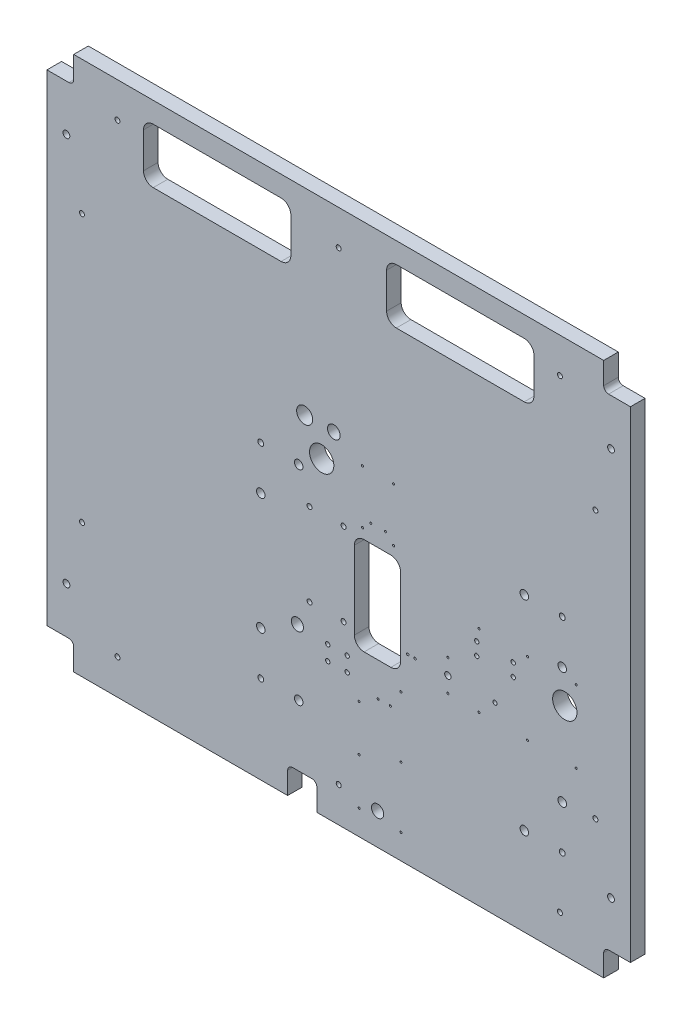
SolidWorks part; units mm, degrees
ref_plane "Ebene vorne" through (0, 0, 0) normal (0, 0, 1) x (1, 0, 0)
ref_plane "Ebene oben" through (0, 0, 0) normal (0, 1, 0) x (1, 0, 0)
ref_plane "Ebene rechts" through (0, 0, 0) normal (1, 0, 0) x (0, 0, -1)
sketch "Skizze1" plane through (0, 0, 0) normal (0, 0, 1) x (1, 0, 0)
  line L1 (-600, -550) -> (600, -550)
  line L2 (-600, -550) -> (-600, 550)
  line L3 (-600, 550) -> (600, 550)
  line L4 (600, -550) -> (600, 550)
  line L5 (-600, -550) -> (600, 550) construction
  line L6 (-600, 550) -> (600, -550) construction
  point P0 (0, 0)
  dimension "D1" = 1200
  dimension "D2" = 1100
extrude "Aufsatz-Linear austragen1" add sketch "Skizze1" along normal blind 30
sketch "Skizze2" plane through (0, 0, 0) normal (0, 0, -1) x (-1, 0, 0)
  line L1 (-32.2293, -215.6) -> (-127.2293, -215.6)
  line L2 (-32.2293, -215.6) -> (-32.2293, -15.6)
  line L3 (-32.2293, -15.6) -> (-127.2293, -15.6)
  line L12 (-127.2293, -215.6) -> (-127.2293, -15.6)
  line L16 (-52.2293, -25.6) -> (-107.2293, -25.6) construction
  line L17 (-42.2293, -195.6) -> (-42.2293, -35.6) construction
  line L18 (-107.2293, -205.6) -> (-52.2293, -205.6) construction
  line L19 (-117.2293, -195.6) -> (-117.2293, -35.6) construction
  dimension "D2" = 10
  dimension "D3" = 10
  dimension "D4" = 10
  dimension "D1" = 10
extrude "Schnitt-Linear austragen1" cut sketch "Skizze2" against normal through all
hole_wizard "Durchgangsloch für M81" positions "Skizze7" profile "Skizze6" hole size "M8" standard "DIN"
sketch "Skizze7" plane through (0, 0, 30) normal (0, 0, 1) x (1, 0, 0)
  circle A2 centre (358.9553, -80.947) radius 5.1167
  circle A3 centre (358.9553, -80.947) radius 3.4 construction
  circle A4 centre (358.9553, -80.947) radius 3.4
  point P0 (358.9553, -80.947)
sketch "Skizze6" plane through (358.9553, -80.947, 30) normal (1, 0, 0) x (0, -1, 0)
  line L0 (0, 0) -> (0, 30)
  line L1 (0, 30) -> (4.5, 30)
  line L2 (4.5, 30) -> (4.5, 0)
  line L5 (4.5, 0) -> (0, 0)
  line L11 (0, -6.35) -> (0, 107.95) construction
  dimension "Bohrerdurchmesser" = 9
  dimension "Bohrungstiefe" = 30
pattern_linear "Lineares Muster1" count 2 spacing 75 along (-1, 0, 0) count 2 spacing 26 along (0, -1, 0) of "Durchgangsloch für M81"
hole_wizard "M10 Gewindebohrung1" positions "Skizze9" profile "Skizze8" tap size "M10" standard "DIN"
sketch "Skizze9" plane through (0, 0, 0) normal (0, 0, -1) x (-1, 0, 0)
  circle A0 centre (-321.4553, -171.447) radius 5 construction
  circle A1 centre (-321.4553, -171.447) radius 5
  point P0 (-321.4553, -171.447)
sketch "Skizze8" plane through (321.4553, -171.447, 0) normal (1, 0, 0) x (0, 1, 0)
  line L0 (0, 0) -> (0, 30)
  line L1 (0, 30) -> (4.25, 30)
  line L2 (4.25, 30) -> (4.25, 0)
  line L5 (4.25, 0) -> (0, 0)
  line L11 (0, -6.35) -> (0, 107.95) construction
  dimension "Bohrerdurchmesser" = 8.5
  dimension "Bohrungstiefe" = 30
hole_wizard "M5 Gewindebohrung1" positions "Skizze11" profile "Skizze10" tap size "M5" standard "DIN"
sketch "Skizze11" plane through (0, 0, 0) normal (0, 0, -1) x (-1, 0, 0)
  circle A0 centre (-65.9283, 20.553) radius 2.75 construction
  circle A1 centre (-65.9283, 20.553) radius 2.75
  circle A2 centre (-95.9283, 20.553) radius 2.75 construction
  circle A3 centre (-95.9283, 20.553) radius 2.75
  point P0 (-65.9283, 20.553)
  point P1 (-95.9283, 20.553)
sketch "Skizze10" plane through (65.9283, 20.553, 0) normal (1, 0, 0) x (0, 1, 0)
  line L0 (0, 0) -> (0, 30)
  line L1 (0, 30) -> (2.1, 30)
  line L2 (2.1, 30) -> (2.1, 0)
  line L5 (2.1, 0) -> (0, 0)
  line L11 (0, -6.35) -> (0, 107.95) construction
  dimension "Bohrerdurchmesser" = 4.2
  dimension "Bohrungstiefe" = 30
hole_wizard "M5 Gewindebohrung2" positions "Skizze13" profile "Skizze12" tap size "M5" standard "DIN"
sketch "Skizze13" plane through (0, 0, 30) normal (0, 0, 1) x (1, 0, 0)
  circle A0 centre (106.2293, -284.927) radius 2.75 construction
  circle A1 centre (81.2293, -284.927) radius 2.75 construction
  circle A2 centre (106.2293, -284.927) radius 2.75
  circle A3 centre (81.2293, -284.927) radius 2.75
  point P0 (106.2293, -284.927)
  point P1 (81.2293, -284.927)
sketch "Skizze12" plane through (106.2293, -284.927, 30) normal (1, 0, 0) x (0, -1, 0)
  line L0 (0, 0) -> (0, 30)
  line L1 (0, 30) -> (2.1, 30)
  line L2 (2.1, 30) -> (2.1, 0)
  line L5 (2.1, 0) -> (0, 0)
  line L11 (0, -6.35) -> (0, 107.95) construction
  dimension "Bohrerdurchmesser" = 4.2
  dimension "Bohrungstiefe" = 30
hole_wizard "M5 Gewindebohrung3" positions "Skizze15" profile "Skizze14" tap size "M5" standard "DIN"
sketch "Skizze15" plane through (0, 0, 30) normal (0, 0, 1) x (1, 0, 0)
  circle A0 centre (224.4553, -139.447) radius 2.75 construction
  circle A1 centre (224.4553, -203.447) radius 2.75 construction
  circle A2 centre (224.4553, -139.447) radius 2.75
  circle A3 centre (224.4553, -203.447) radius 2.75
  point P0 (224.4553, -139.447)
  point P1 (224.4553, -203.447)
sketch "Skizze14" plane through (224.4553, -139.447, 30) normal (1, 0, 0) x (0, -1, 0)
  line L0 (0, 0) -> (0, 30)
  line L1 (0, 30) -> (2.1, 30)
  line L2 (2.1, 30) -> (2.1, 0)
  line L5 (2.1, 0) -> (0, 0)
  line L11 (0, -6.35) -> (0, 107.95) construction
  dimension "Bohrerdurchmesser" = 4.2
  dimension "Bohrungstiefe" = 30
hole_wizard "Ø13.0 (13) Durchmesser Bohrung1" positions "Skizze17" profile "Skizze16" hole size "Ø13.0" standard "DIN"
sketch "Skizze17" plane through (0, 0, 0) normal (0, 0, -1) x (-1, 0, 0)
  circle A0 centre (-224.4553, -171.447) radius 4.75 construction
  point P0 (-224.4553, -171.447)
sketch "Skizze16" plane through (224.4553, -171.447, 0) normal (1, 0, 0) x (0, 1, 0)
  line L0 (0, 0) -> (0, 30)
  line L1 (0, 30) -> (6.5, 30)
  line L2 (6.5, 30) -> (6.5, 0)
  line L5 (6.5, 0) -> (0, 0)
  line L11 (0, -6.35) -> (0, 107.95) construction
  dimension "Bohrerdurchmesser" = 13
  dimension "Bohrungstiefe" = 30
sketch "Skizze18" plane through (0, 0, 0) normal (0, 0, -1) x (-1, 0, 0)
  line L0 (600, -550) -> (-600, -550) construction
  line L1 (-600, 550) -> (-545, 550)
  line L2 (-600, 550) -> (-600, 495)
  line L3 (-600, 495) -> (-545, 495)
  line L4 (-545, 550) -> (-545, 495)
  line L5 (600, 550) -> (545, 550)
  line L6 (600, 550) -> (600, 495)
  line L7 (600, 495) -> (545, 495)
  line L8 (545, 550) -> (545, 495)
  line L9 (600, -550) -> (545, -550)
  line L10 (600, -550) -> (600, -495)
  line L11 (600, -495) -> (545, -495)
  line L12 (545, -550) -> (545, -495)
  line L13 (-600, -550) -> (-545, -550)
  line L14 (-600, -550) -> (-600, -495)
  line L15 (-600, -495) -> (-545, -495)
  line L16 (-545, -550) -> (-545, -495)
  line L17 (45, -550) -> (105, -550)
  line L18 (45, -550) -> (45, -495)
  line L19 (45, -495) -> (105, -495)
  line L20 (105, -550) -> (105, -495)
  line L21 (600, 550) -> (600, -550) construction
  dimension "D1" = 55
  dimension "D2" = 495
  dimension "D3" = 60
extrude "Schnitt-Linear austragen2" cut sketch "Skizze18" against normal through all
hole_wizard "M16 Gewindebohrung1" positions "Skizze20" profile "Skizze19" tap size "M16" standard "DIN"
sketch "Skizze20" plane through (0, 0, 0) normal (0, 0, -1) x (-1, 0, 0)
  line L0 (-600, -495) -> (-600, 495) construction
  line L1 (600, 495) -> (600, -495) construction
  line L2 (-545, 550) -> (545, 550) construction
  line L3 (545, -550) -> (105, -550) construction
  point P0 (-560, -400)
  point P1 (-560, 400)
  point P3 (560, 400)
  point P5 (560, -400)
  dimension "D1" = 40
  dimension "D2" = 40
  dimension "D3" = 150
  dimension "D4" = 150
sketch "Skizze19" plane through (560, -400, 0) normal (1, 0, 0) x (0, 1, 0)
  line L0 (0, 0) -> (0, 30)
  line L1 (0, 30) -> (7, 30)
  line L2 (7, 30) -> (7, 0)
  line L5 (7, 0) -> (0, 0)
  line L11 (0, -6.35) -> (0, 107.95) construction
  dimension "Bohrerdurchmesser" = 14
  dimension "Bohrungstiefe" = 30
hole_wizard "M6 Gewindebohrung1" positions "Skizze22" profile "Skizze21" tap size "M6" standard "DIN"
sketch "Skizze22" plane through (0, 0, 0) normal (0, 0, -1) x (-1, 0, 0)
  circle A0 centre (-157, -175) radius 3.3 construction
  circle A1 centre (-142, -175) radius 3.3 construction
  point P0 (-157, -175)
  point P1 (-142, -175)
sketch "Skizze21" plane through (157, -175, 0) normal (1, 0, 0) x (0, 1, 0)
  line L0 (0, 0) -> (0, 30)
  line L1 (0, 30) -> (2.5, 30)
  line L2 (2.5, 30) -> (2.5, 0)
  line L5 (2.5, 0) -> (0, 0)
  line L11 (0, -6.35) -> (0, 107.95) construction
  dimension "Bohrerdurchmesser" = 5
  dimension "Bohrungstiefe" = 30
sketch "Skizze25" plane through (0, 0, 30) normal (0, 0, 1) x (1, 0, 0)
  line L0 (-98.5, 394.5) -> (-98.5, 507.5) construction
  line L1 (-401.5, 394.5) -> (-98.5, 394.5) construction
  line L2 (-401.5, 507.5) -> (-401.5, 394.5) construction
  line L3 (-98.5, 507.5) -> (-401.5, 507.5) construction
  line L4 (-98.5, 394.5) -> (-98.5, 507.5)
  line L5 (-401.5, 394.5) -> (-98.5, 394.5)
  line L6 (-401.5, 507.5) -> (-401.5, 394.5)
  line L7 (-98.5, 507.5) -> (-401.5, 507.5)
  line L8 (98.5, 394.5) -> (401.5, 394.5) construction
  line L9 (98.5, 507.5) -> (98.5, 394.5) construction
  line L10 (401.5, 507.5) -> (98.5, 507.5) construction
  line L11 (401.5, 394.5) -> (401.5, 507.5) construction
  line L12 (98.5, 394.5) -> (401.5, 394.5)
  line L13 (98.5, 507.5) -> (98.5, 394.5)
  line L14 (401.5, 507.5) -> (98.5, 507.5)
  line L15 (401.5, 394.5) -> (401.5, 507.5)
extrude "Schnitt-Linear austragen3" cut sketch "Skizze25" against normal through all
hole_wizard "Ø26.0 (26) Durchmesser Bohrung1" positions "Skizze27" profile "Skizze26" hole size "Ø26.0" standard "DIN"
sketch "Skizze27" plane through (0, 0, 0) normal (0, 0, -1) x (-1, 0, 0)
  line L0 (-73.5697, -63.484) -> (-57.497, -24.681) construction
  line L6 (545, -550) -> (105, -550) construction
  line L7 (-600, -495) -> (-600, 495) construction
  point P0 (10, 145)
  dimension "D1" = 695
  dimension "D2" = 610
sketch "Skizze26" plane through (-10, 145, 0) normal (1, 0, 0) x (0, 1, 0)
  line L0 (0, 0) -> (0, 30)
  line L1 (0, 30) -> (13, 30)
  line L2 (13, 30) -> (13, 0)
  line L5 (13, 0) -> (0, 0)
  line L11 (0, -6.35) -> (0, 107.95) construction
  dimension "Bohrerdurchmesser" = 26
  dimension "Bohrungstiefe" = 30
sketch "Skizze30" plane through (0, 0, 0) normal (0, 0, -1) x (-1, 0, 0)
  circle A0 centre (-465, -105) radius 25
  circle A1 centre (35, 85) radius 25
  circle A2 centre (85, -235) radius 12.5
  circle A3 centre (-80, -485) radius 12.5
  circle A4 centre (10, 145) radius 13 construction
  dimension "D1" = 50
  dimension "D7" = 60
  dimension "D8" = 25
  dimension "D11" = 25
  dimension "D2" = 25
  dimension "D3" = 320
  dimension "D4" = 500
  dimension "D5" = 190
  dimension "D6" = 550
  dimension "D9" = 385
  dimension "D10" = 380
extrude "Schnitt-Linear austragen4" cut sketch "Skizze30" against normal through all
hole_wizard "Ø33.0 (33) Durchmesser Bohrung1" positions "Skizze33" profile "Skizze32" hole size "Ø33.0" standard "DIN"
sketch "Skizze33" plane through (0, 0, 0) normal (0, 0, -1) x (-1, 0, 0)
  circle A0 centre (10, 145) radius 13 construction
  circle A1 centre (10, 145) radius 13
  point P0 (70, 145)
  dimension "D1" = 60
sketch "Skizze32" plane through (-70, 145, 0) normal (1, 0, 0) x (0, 1, 0)
  line L0 (0, 0) -> (0, 30)
  line L1 (0, 30) -> (16.5, 30)
  line L2 (16.5, 30) -> (16.5, 0)
  line L5 (16.5, 0) -> (0, 0)
  line L11 (0, -6.35) -> (0, 107.95) construction
  dimension "Bohrerdurchmesser" = 33
  dimension "Bohrungstiefe" = 30
hole_wizard "M5 Gewindebohrung Deckbleche" positions "Skizze35" profile "Skizze34" tap size "M5" standard "DIN"
sketch "Skizze35" plane through (0, 0, 30) normal (0, 0, 1) x (1, 0, 0)
  circle A0 centre (112.9283, 4.053) radius 2.75 construction
  circle A1 centre (48.9283, 4.053) radius 2.75 construction
  circle A2 centre (48.9283, 114.053) radius 2.75 construction
  circle A3 centre (112.9283, 114.053) radius 2.75 construction
  circle A4 centre (488.4553, -55.947) radius 2.75 construction
  circle A5 centre (388.4553, -55.947) radius 2.75 construction
  circle A6 centre (288.4553, -55.947) radius 2.75 construction
  circle A7 centre (488.4553, -204.947) radius 2.75 construction
  circle A8 centre (388.4553, -204.947) radius 2.75 construction
  circle A9 centre (288.4553, -204.947) radius 2.75 construction
  circle A10 centre (128.0293, -248.8515) radius 2.75 construction
  circle A11 centre (128.0293, -373.8515) radius 2.75 construction
  circle A12 centre (128.0293, -498.8515) radius 2.75 construction
  circle A13 centre (42.0293, -498.8515) radius 2.75 construction
  circle A14 centre (42.0293, -403.8515) radius 2.75 construction
  circle A15 centre (42.0293, -308.8515) radius 2.75 construction
  point P0 (288.4553, -204.947)
  point P1 (42.0293, -498.8515)
  point P3 (42.0293, -403.8515)
  point P5 (128.0293, -498.8515)
  point P7 (128.0293, -373.8515)
  point P9 (128.0293, -248.8515)
  point P11 (488.4553, -55.947)
  point P13 (388.4553, -55.947)
  point P15 (288.4553, -55.947)
  point P17 (488.4553, -204.947)
  point P19 (388.4553, -204.947)
  point P21 (48.9283, 114.053)
  point P23 (48.9283, 4.053)
  point P25 (112.9283, 4.053)
  point P27 (112.9283, 114.053)
  point P61 (42.0293, -308.8515)
sketch "Skizze34" plane through (288.4553, -204.947, 30) normal (1, 0, 0) x (0, -1, 0)
  line L0 (0, 0) -> (0, 30)
  line L1 (0, 30) -> (2.1, 30)
  line L2 (2.1, 30) -> (2.1, 0)
  line L5 (2.1, 0) -> (0, 0)
  line L11 (0, -6.35) -> (0, 107.95) construction
  dimension "Bohrerdurchmesser" = 4.2
  dimension "Bohrungstiefe" = 30
hole_wizard "Durchgangsloch für M161" positions "Skizze37" profile "Skizze36" hole size "M16" standard "DIN"
sketch "Skizze37" plane through (0, 0, 0) normal (0, 0, -1) x (-1, 0, 0)
  circle A0 centre (-381.7293, 50.9) radius 7 construction
  circle A1 centre (-459.7293, -39.1) radius 7 construction
  circle A2 centre (-459.7293, -279.1) radius 7 construction
  circle A3 centre (-381.7293, -369.1) radius 7 construction
  circle A4 centre (82.2707, 50.9) radius 7 construction
  circle A5 centre (160.2707, -39.1) radius 7 construction
  circle A6 centre (160.2707, -279.1) radius 7 construction
  circle A7 centre (82.2707, -369.1) radius 7 construction
  point P0 (-381.7293, -369.1)
  point P1 (-459.7293, -39.1)
  point P3 (-381.7293, 50.9)
  point P8 (-459.7293, -279.1)
  point P11 (82.2707, 50.9)
  point P13 (160.2707, -39.1)
  point P15 (160.2707, -279.1)
  point P17 (82.2707, -369.1)
sketch "Skizze36" plane through (381.7293, -369.1, 0) normal (1, 0, 0) x (0, 1, 0)
  line L0 (0, 0) -> (0, 30)
  line L1 (0, 30) -> (8.75, 30)
  line L2 (8.75, 30) -> (8.75, 0)
  line L5 (8.75, 0) -> (0, 0)
  line L11 (0, -6.35) -> (0, 107.95) construction
  dimension "Bohrerdurchmesser" = 17.5
  dimension "Bohrungstiefe" = 30
hole_wizard "Ø12.0 (12) Durchmesser Bohrung1" positions "Skizze39" profile "Skizze38" hole size "Ø12.0" standard "DIN"
sketch "Skizze39" plane through (0, 0, 0) normal (0, 0, -1) x (-1, 0, 0)
  circle A0 centre (-459.7293, 50.9) radius 6 construction
  circle A1 centre (-459.7293, -369.1) radius 6 construction
  circle A2 centre (160.2707, 50.9) radius 6 construction
  circle A3 centre (160.2707, -369.1) radius 6 construction
  point P0 (-459.7293, 50.9)
  point P1 (-459.7293, -369.1)
  point P3 (160.2707, -369.1)
  point P5 (160.2707, 50.9)
sketch "Skizze38" plane through (459.7293, 50.9, 0) normal (1, 0, 0) x (0, 1, 0)
  line L0 (0, 0) -> (0, 30)
  line L1 (0, 30) -> (6, 30)
  line L2 (6, 30) -> (6, 0)
  line L5 (6, 0) -> (0, 0)
  line L11 (0, -6.35) -> (0, 107.95) construction
  dimension "Bohrerdurchmesser" = 12
  dimension "Bohrungstiefe" = 30
hole_wizard "Durchgangsloch für M82" positions "Skizze41" profile "Skizze40" hole size "M8" standard "DIN"
sketch "Skizze41" plane through (0, 0, 30) normal (0, 0, 1) x (1, 0, 0)
  circle A0 centre (17.4553, -239.447) radius 3.4 construction
  circle A1 centre (-22.5447, -239.447) radius 3.4 construction
  circle A2 centre (17.4553, -269.447) radius 3.4 construction
  circle A3 centre (-22.5447, -269.447) radius 3.4 construction
  point P0 (-22.5447, -269.447)
  point P1 (17.4553, -269.447)
  point P3 (17.4553, -239.447)
  point P5 (-22.5447, -239.447)
sketch "Skizze40" plane through (-22.5447, -269.447, 30) normal (1, 0, 0) x (0, -1, 0)
  line L0 (0, 0) -> (0, 30)
  line L1 (0, 30) -> (4.5, 30)
  line L2 (4.5, 30) -> (4.5, 0)
  line L5 (4.5, 0) -> (0, 0)
  line L11 (0, -6.35) -> (0, 107.95) construction
  dimension "Bohrerdurchmesser" = 9
  dimension "Bohrungstiefe" = 30
fillet "Verrundung1" radius 20 8 edges at (401.5, 394.5, 15) (-98.5, 394.5, 15) (98.5, 394.5, 15) (-401.5, 394.5, 15) (-401.5, 507.5, 15) (98.5, 507.5, 15) (-98.5, 507.5, 15) (401.5, 507.5, 15)
fillet "Verrundung2" radius 20 4 edges at (32.2293, -215.6, 15) (127.2293, -215.6, 15) (127.2293, -15.6, 15) (32.2293, -15.6, 15)
hole_wizard "M12 Gewindebohrung3" positions "Skizze43" profile "Skizze42" tap size "M12" standard "DIN"
sketch "Skizze43" plane through (320.3074, -292.1312, 0) normal (0, 0, 1) x (1, 0, 0)
  circle A0 centre (134.6926, 770.1312) radius 7 construction
  circle A1 centre (-320.3074, 770.1312) radius 7 construction
  circle A2 centre (-775.3074, 770.1312) radius 7 construction
  circle A3 centre (-848.3074, 567.1312) radius 7 construction
  circle A4 centre (-848.3074, 17.1312) radius 7 construction
  circle A5 centre (-775.3074, -185.8688) radius 7 construction
  circle A6 centre (-320.3074, -185.8688) radius 7 construction
  circle A7 centre (134.6926, -185.8688) radius 7 construction
  circle A8 centre (207.6926, 17.1312) radius 7 construction
  circle A9 centre (207.6926, 567.1312) radius 7 construction
  circle A10 centre (-310.3074, 109.4099) radius 6.75 construction
  circle A11 centre (-380.3074, 109.4099) radius 6.75 construction
  circle A12 centre (-310.3074, 279.4099) radius 6.75 construction
  circle A13 centre (-380.3074, 279.4099) radius 6.75 construction
  point P0 (134.6926, 770.1312)
  point P1 (-320.3074, 770.1312)
  point P3 (-775.3074, 770.1312)
  point P5 (-848.3074, 567.1312)
  point P7 (-848.3074, 17.1312)
  point P9 (-775.3074, -185.8688)
  point P11 (134.6926, -185.8688)
  point P13 (-320.3074, -185.8688)
  point P15 (207.6926, 567.1312)
  point P17 (207.6926, 17.1312)
  point P42 (-310.3074, 109.4099)
  point P44 (-380.3074, 109.4099)
  point P46 (-310.3074, 279.4099)
  point P48 (-380.3074, 279.4099)
sketch "Skizze42" plane through (455, 478, 0) normal (1, 0, 0) x (0, 1, 0)
  line L0 (0, 0) -> (0, 30)
  line L1 (0, 30) -> (5.1, 30)
  line L2 (5.1, 30) -> (5.1, 0)
  line L5 (5.1, 0) -> (0, 0)
  line L11 (0, -6.35) -> (0, 107.95) construction
  dimension "Bohrerdurchmesser" = 10.2
  dimension "Bohrungstiefe" = 30
fillet "Verrundung3" radius 10 6 edges at (545, 495, 15) (-545, 495, 15) (-545, -495, 15) (-45, -495, 15) (-105, -495, 15) (545, -495, 15)
